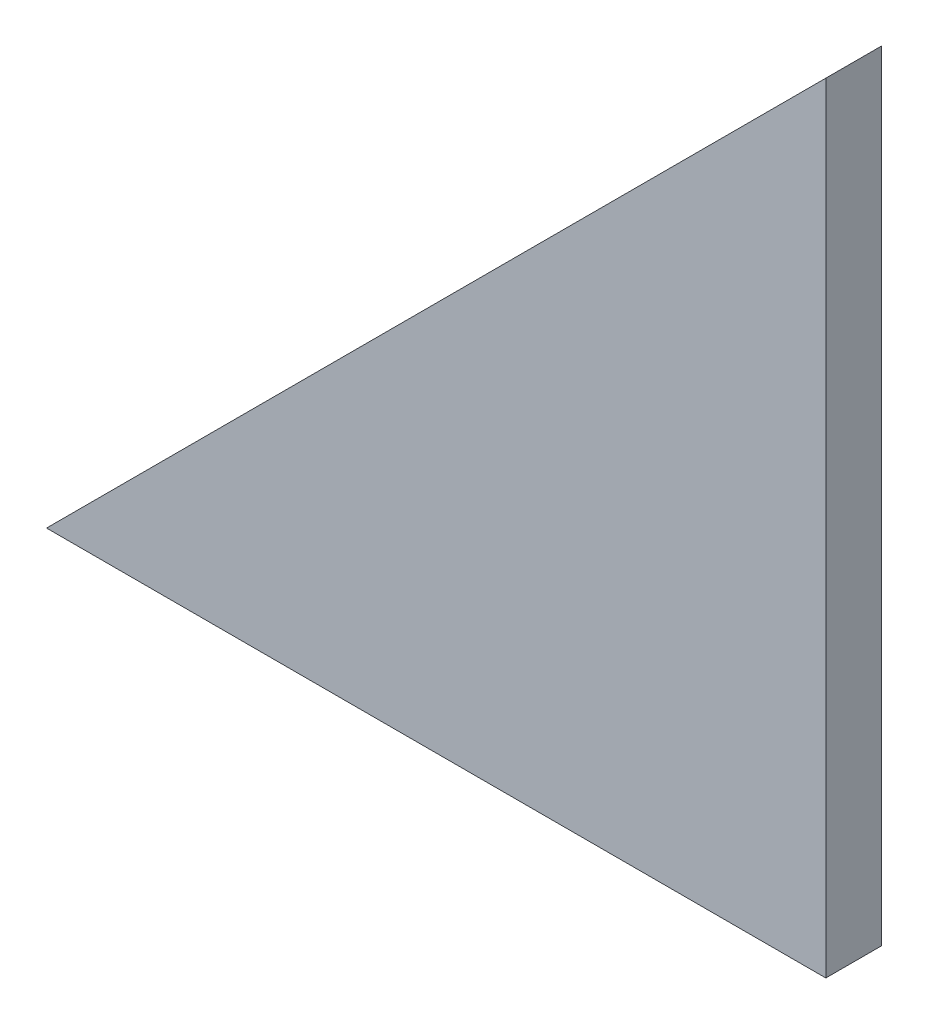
SolidWorks part; units mm, degrees
ref_plane "Front" through (0, 0, 0) normal (0, 0, 1) x (1, 0, 0)
ref_plane "Top" through (0, 0, 0) normal (0, 1, 0) x (1, 0, 0)
ref_plane "Right" through (0, 0, 0) normal (1, 0, 0) x (0, 0, -1)
sketch "Sketch1" plane through (0, 0, 0) normal (0, 0, 1) x (1, 0, 0)
  line L0 (0, 0) -> (88.9, 0)
  line L1 (88.9, 0) -> (88.9, 88.9)
  line L2 (88.9, 88.9) -> (0, 0)
  dimension "D1" = 88.9
  dimension "D2" = 88.9
extrude "Extrude1" add sketch "Sketch1" along normal blind 6.35
